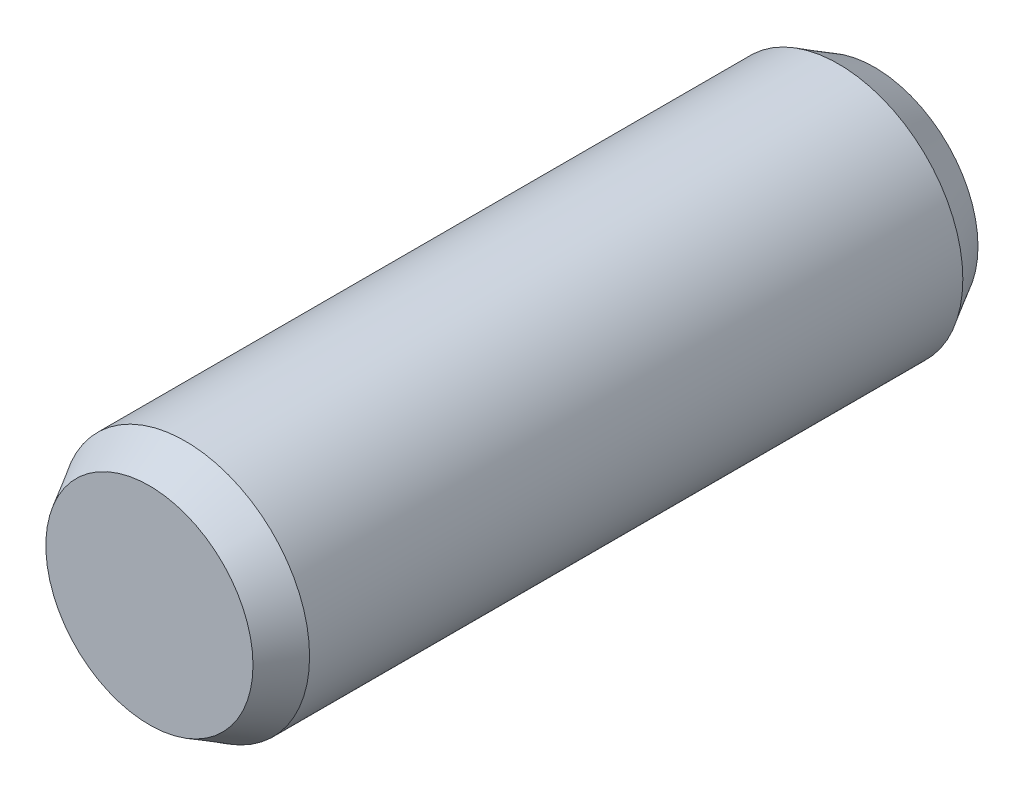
SolidWorks part; units mm, degrees
ref_plane "Face" through (0, 0, 0) normal (0, 0, 1) x (1, 0, 0)
ref_plane "Dessus" through (0, 0, 0) normal (0, 1, 0) x (1, 0, 0)
ref_plane "Droite" through (0, 0, 0) normal (1, 0, 0) x (0, 0, -1)
sketch "Esquisse1" plane through (0, 0, 0) normal (0, 0, 1) x (1, 0, 0)
  circle A0 centre (0, 0) radius 6
  dimension "D1" = 12
extrude "Extrusion1" add sketch "Esquisse1" along normal mid plane 35
chamfer "Chanfrein1" distance 1 angle 60 1 edges at (6, 0, -17.5)
chamfer "Chanfrein2" distance 1 angle 60 1 edges at (6, 0, 17.5)
